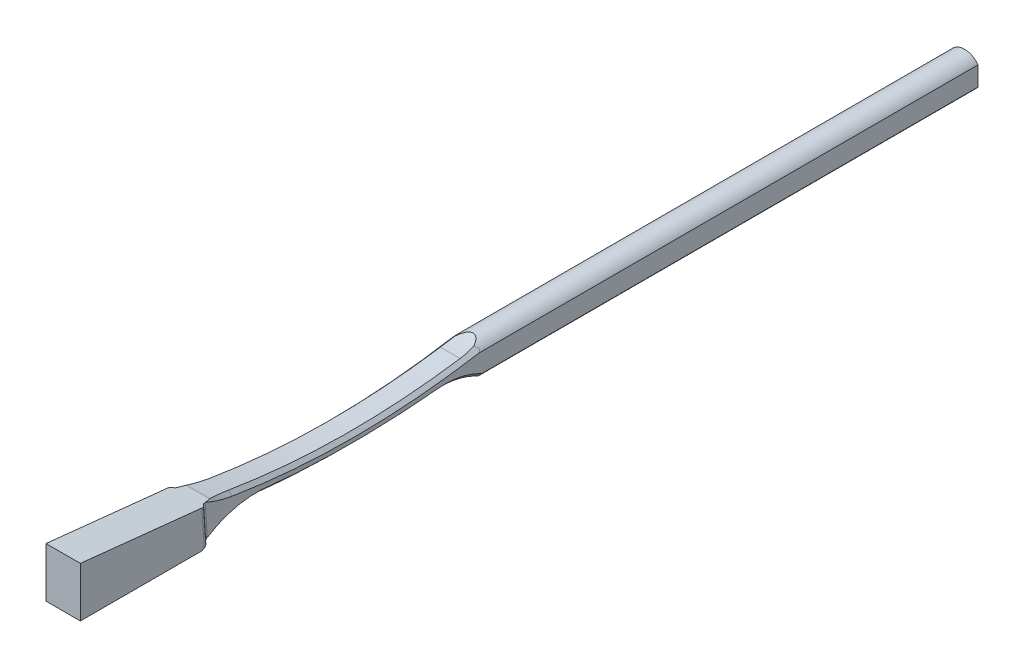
SolidWorks part; units mm, degrees
ref_plane "Front Plane" through (0, 0, 0) normal (0, 0, 1) x (1, 0, 0)
ref_plane "Top Plane" through (0, 0, 0) normal (0, 1, 0) x (1, 0, 0)
ref_plane "Right Plane" through (0, 0, 0) normal (1, 0, 0) x (0, 0, -1)
sketch "Sketch2" plane through (0, 0, 0) normal (1, 0, 0) x (0, 0, -1)
  line L0 (162.5, 0.5282) -> (162.5, 6.4718)
  line L1 (73.9, 6.4718) -> (162.5, 6.4718)
  line L2 (73.9, 0.5282) -> (162.5, 0.5282)
  line L3 (73.9, -5.4498) -> (73.9, 9.9567) construction
  line L341 (0, 0) -> (0, 9)
  line L342 (22, 0) -> (0, 0)
  line L343 (0, 9) -> (24.3, 6.446)
  line L344 (169.4282, 3.5) -> (-1.2005, 3.5) construction
  arc A0 (33.2357, 2.8589) -> (65.0271, 2.7361) centre (49.7243, 156.3152) ccw
  arc A1 (24.3, 6.446) -> (69.7669, 5.4327) centre (49.9861, 138.4313) ccw
  arc A2 (73.9, 0.5282) -> (65.0271, 2.7361) centre (66.3742, -10.7833) ccw
  arc A3 (69.7669, 5.4327) -> (73.9, 6.4718) centre (66.5842, 26.8321) ccw
  arc A4 (33.2357, 2.8589) -> (22, 0) centre (31.6916, -14.5809) ccw
  dimension "D4" = 17.508
  dimension "D5" = 154.3397
  dimension "D6" = 134.4615
  dimension "D8" = 49.9861
  dimension "D9" = 31.6916
  dimension "D10" = 49.7243
  dimension "D11" = 138.4313
  dimension "D12" = 21.6348
  dimension "D14" = 156.3152
  dimension "D16" = 13.5863
  dimension "D1" = 3.5
  dimension "D2" = 22
  dimension "D3" = 9
  dimension "D7" = 6
  dimension "D15" = 162.5
  dimension "D20" = 2.9718
  dimension "D21" = 2.9718
  dimension "D22" = 5.9436
  dimension "D23" = 88.6
extrude "Main Body" add sketch "Sketch2" along normal mid plane 4.826
sketch "Sketch4" plane through (0, 0, 0) normal (1, 0, 0) x (0, 0, -1)
  line L0 (23.1841, 6.5633) -> (23.5625, 0.9255)
  line L7 (73.9, 0.5282) -> (162.5, 0.5282)
  line L9 (162.5, 0.5282) -> (162.5, 6.4718)
  line L11 (162.5, 6.4718) -> (73.9, 6.4718)
  line L13 (24.3, 6.446) -> (0, 9)
  line L14 (23.1841, 6.5633) -> (0, 9)
  line L15 (0, 9) -> (0, 0)
  line L16 (0, 9) -> (0, 0)
  line L17 (0, 0) -> (22, 0)
  line L18 (0, 0) -> (22, 0)
  arc A5 (73.9, 0.5282) -> (65.0271, 2.7361) centre (66.3742, -10.7833) ccw
  arc A7 (69.7669, 5.4327) -> (73.9, 6.4718) centre (66.5842, 26.8321) ccw
  arc A9 (24.3, 6.446) -> (69.7669, 5.4327) centre (49.9861, 138.4313) ccw
  arc A11 (33.2357, 2.8589) -> (22, 0) centre (31.6916, -14.5809) ccw
  arc A12 (23.5625, 0.9255) -> (22, 0) centre (31.6916, -14.5809) ccw
  arc A13 (33.2357, 2.8589) -> (65.0271, 2.7361) centre (49.7243, 156.3152) ccw
  dimension "D2" = 86.16
  dimension "D3" = 23.5716
  dimension "D1" = 0
extrude "Head for impression" add sketch "Sketch4" along normal mid plane 6.1976
ref_plane "Plane1" through (0, -0.6531, -0.0438) normal (0, -0.9978, -0.067) x (1, 0, 0)
sketch "Sketch7" plane through (0, -0.6552, -0.0125) normal (0, 0.9978, 0.067) x (1, 0, 0)
  line L0 (-2.413, 70.0055) -> (-2.413, 24.7086) construction
  line L2 (-3.0988, 22.323) -> (-3.0988, 20.1589)
  line L3 (-2.413, 23.5958) -> (-2.413, 26.3708)
  line L4 (3.0988, 0.6342) -> (-3.0988, 0.6342) construction
  line L5 (-3.0988, 23.603) -> (-3.0988, 0.6342) construction
  line L6 (4.5373, 20.1589) -> (3.0988, 20.1589)
  line L7 (4.5373, 26.3708) -> (4.5373, 20.1589)
  line L8 (-2.413, 26.3708) -> (-4.5373, 26.3708)
  line L9 (-4.5373, 26.3708) -> (-4.5373, 20.1589)
  line L10 (-4.5373, 20.1589) -> (-3.0988, 20.1589)
  line L11 (0, 0.0314) -> (0, -177.0531) construction
  line L12 (2.413, 26.3708) -> (4.5373, 26.3708)
  line L13 (2.413, 23.5958) -> (2.413, 26.3708)
  line L14 (3.0988, 22.323) -> (3.0988, 20.1589)
  arc A0 (-2.7559, 22.9594) -> (-3.0988, 22.323) centre (-2.3368, 22.323) ccw
  arc A1 (-2.413, 23.5958) -> (-2.7559, 22.9594) centre (-3.175, 23.5958) cw
  arc A2 (2.413, 23.5958) -> (2.7559, 22.9594) centre (3.175, 23.5958) ccw
  arc A3 (2.7559, 22.9594) -> (3.0988, 22.323) centre (2.3368, 22.323) cw
  dimension "D1" = 0.762
  dimension "D2" = 22.9616
extrude "BLENDED RAD CUT" cut sketch "Sketch7" against normal through all and the other way through all
sketch "Sketch3" plane through (0, 0, -162.5) normal (0, 0, -1) x (-1, 0, 0)
  line L0 (-2.413, 6.4718) -> (2.413, 6.4718) construction
  line L1 (-2.413, 0.5282) -> (2.413, 0.5282) construction
  line L2 (-2.413, 0.5282) -> (-2.413, 6.4718) construction
  line L3 (2.413, 0.5282) -> (2.413, 6.4718) construction
  line L4 (-2.413, 6.4718) -> (2.413, 0.5282) construction
  line L8 (2.413, 0.5282) -> (2.413, 6.4718)
  line L9 (2.413, 6.4718) -> (-2.413, 6.4718)
  line L10 (-2.413, 6.4718) -> (-2.413, 0.5282)
  line L11 (-2.413, 0.5282) -> (2.413, 0.5282)
  circle A0 centre (0, 3.5) radius 2.97
  dimension "D1" = 5.94
extrude "DIA CUT TO SHANK" cut sketch "Sketch3" against normal blind 100 contours L4 A0 M16 | L4 A0 M15 M14 | A0 L4 M14 | L4 A0 M16 M17
sketch "Sketch8" plane through (0, 0, -162.5) normal (0, 0, -1) x (-1, 0, 0)
  circle A0 centre (0, 3.5) radius 2
  arc A1 (-2.413, 1.7684) -> (2.413, 1.7684) centre (0, 3.5) ccw construction
  dimension "D1" = 4
extrude "THREAD M-4" cut sketch "Sketch8" against normal blind 19
sketch "Sketch11" plane through (0, 0, 0) normal (1, 0, 0) x (0, 0, -1)
  line L0 (148.1658, 3.5) -> (169.1916, 3.5) construction
  line L1 (96.5782, 3.5) -> (153.1391, 3.5) construction
  line L2 (162.5, 3.5) -> (162.5, 5.15)
  line L3 (162.5, 5.15) -> (140.5, 5.15)
  line L4 (140.5, 5.15) -> (139.5086, 3.5)
  line L5 (139.5086, 3.5) -> (162.5, 3.5)
  line L6 (162.5, 1.7684) -> (162.5, 5.2316) construction
  dimension "D1" = 59
  dimension "D2" = 3.3
  dimension "D3" = 22
revolve "tap drill 3.3mm" cut sketch "Sketch11" angle 360 about L0
sketch "Sketch12" plane through (2.413, 0, 0) normal (1, 0, 0) x (0, 0, -1)
  arc A0 (71.5744, 1.7684) -> (65.0271, 2.7361) centre (66.3742, -10.7833) ccw construction
  arc A1 (33.2357, 2.8589) -> (65.0271, 2.7361) centre (49.7243, 156.3152) ccw construction
  arc A3 (74, 0.461) -> (65.0271, 2.7361) centre (66.3742, -10.7833) ccw
  arc A4 (33.2357, 2.8589) -> (65.0271, 2.7361) centre (49.7243, 156.3152) ccw
  arc A5 (33.2357, 2.8589) -> (21.3371, -1.6683) centre (32.4583, -12.9977) ccw
  dimension "D2" = 74
ref_plane "Plane2" through (2.413, -1.6683, -21.3371) normal (0, -0.7005, 0.7136) x (1, 0, 0)
sketch "Sketch13" plane through (2.413, -1.6683, -21.3371) normal (0, -0.7005, 0.7136) x (1, 0, 0)
  line L0 (0, 0) -> (0, 0.635)
  line L1 (0, 0.635) -> (-0.635, 0)
  line L2 (0, 0) -> (-0.635, 0) construction
  line L5 (-0.71, -0.075) -> (0, -0.075)
  line L6 (-0.635, 0) -> (-0.71, -0.075)
  line L7 (0, 0) -> (0, -0.075)
  line L9 (0, -5.1044) -> (0, 0) construction
  dimension "D1" = 0.635
  dimension "D2" = 0.635
  dimension "D3" = 0.075
sweep "Cut-Sweep1" cut profiles "Sketch13" path "Sketch12"
sketch "Sketch14" plane through (2.413, 0, 0) normal (1, 0, 0) x (0, 0, -1)
  arc A0 (24.3, 6.446) -> (68.3637, 5.2316) centre (49.9861, 138.4313) ccw construction
  arc A1 (28.0769, 5.7667) -> (78.9189, 7.1195) centre (49.9861, 138.4313) ccw
  spline S0 degree 3 poles (28.0769, 5.7667) (26.9702, 5.9495) (24.356, 6.6317) (21.9318, 7.8163) (20.5138, 8.5093) knots 0 0 0 0 0.415019 1 1 1 1
ref_plane "Plane3" through (2.413, 8.5093, -20.5138) normal (0, 0.4391, 0.8985) x (1, 0, 0)
sketch "Sketch15" plane through (2.413, 8.5093, -20.5138) normal (0, 0.4391, 0.8985) x (1, 0, 0)
  line L0 (0, 0) -> (0, -0.635)
  line L1 (0, -0.635) -> (-0.635, 0)
  line L2 (-0.635, 0) -> (-0.835, 0.2)
  line L3 (-0.835, 0.2) -> (0, 0.2)
  line L4 (0, 0.2) -> (0, 0)
  line L5 (0, 0) -> (-0.635, 0) construction
  dimension "D1" = 0.635
  dimension "D2" = 0.635
  dimension "D3" = 0.2
sweep "Cut-Sweep2" cut profiles "Sketch15" path "Sketch14"
mirror "Mirror1" about plane through (0, 0, 0) normal (1, 0, 0) of "Cut-Sweep1", "Cut-Sweep2"
